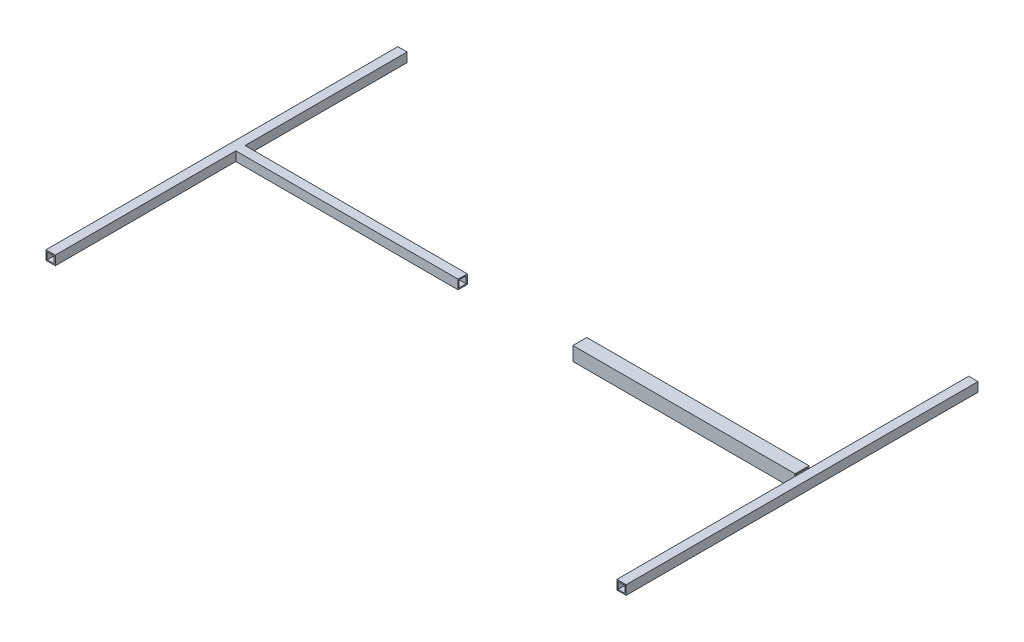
SolidWorks part; units mm, degrees
ref_plane "Front Plane" through (0, 0, 0) normal (0, 0, 1) x (1, 0, 0)
ref_plane "Top Plane" through (0, 0, 0) normal (0, 1, 0) x (1, 0, 0)
ref_plane "Right Plane" through (0, 0, 0) normal (1, 0, 0) x (0, 0, -1)
sketch "Sketch1" plane through (0, 0, 0) normal (0, 1, 0) x (1, 0, 0)
  line L0 (0, 0) -> (0, 482.6)
  line L1 (0, -385.7741) -> (0, 385.7741) construction
  line L2 (0, 254) -> (-304.8, 254)
  line L3 (-391.5217, 0) -> (-391.5217, 701.4075) construction
  line L4 (-783.0434, 254) -> (-478.2434, 254)
  line L5 (-783.0434, 0) -> (-783.0434, 482.6)
  point P13 (-783.0434, 482.6)
  dimension "D1" = 482.6
  dimension "D2" = 304.8
  dimension "D3" = 254
sketch "Sketch2" plane through (0, 0, 0) normal (0, 0, 1) x (1, 0, 0)
  line L0 (-783.0434, 0) -> (-478.2434, 0) construction
  line L1 (-789.3934, -6.35) -> (-776.6934, -6.35)
  line L2 (-789.3934, -6.35) -> (-789.3934, 6.35)
  line L3 (-789.3934, 6.35) -> (-776.6934, 6.35)
  line L4 (-776.6934, -6.35) -> (-776.6934, 6.35)
  line L5 (-789.3934, -6.35) -> (-776.6934, 6.35) construction
  line L6 (-789.3934, 6.35) -> (-776.6934, -6.35) construction
  line L8 (-6.35, -6.35) -> (6.35, -6.35)
  line L9 (-6.35, -6.35) -> (-6.35, 6.35)
  line L10 (-6.35, 6.35) -> (6.35, 6.35)
  line L11 (6.35, -6.35) -> (6.35, 6.35)
  line L12 (-6.35, -6.35) -> (6.35, 6.35) construction
  line L13 (-6.35, 6.35) -> (6.35, -6.35) construction
  line L14 (-787.8059, -4.7625) -> (-778.2809, -4.7625)
  line L15 (-787.8059, -4.7625) -> (-787.8059, 4.7625)
  line L16 (-787.8059, 4.7625) -> (-778.2809, 4.7625)
  line L17 (-778.2809, -4.7625) -> (-778.2809, 4.7625)
  line L18 (-787.8059, -4.7625) -> (-778.2809, 4.7625) construction
  line L19 (-787.8059, 4.7625) -> (-778.2809, -4.7625) construction
  line L20 (-4.7625, -4.7625) -> (4.7625, -4.7625)
  line L21 (-4.7625, -4.7625) -> (-4.7625, 4.7625)
  line L22 (-4.7625, 4.7625) -> (4.7625, 4.7625)
  line L23 (4.7625, -4.7625) -> (4.7625, 4.7625)
  line L24 (-4.7625, -4.7625) -> (4.7625, 4.7625) construction
  line L25 (-4.7625, 4.7625) -> (4.7625, -4.7625) construction
  point P0 (-783.0434, 0)
  point P7 (0, 0)
  point P13 (-783.0434, 0)
  point P18 (0, 0)
  dimension "D1" = 12.7
  dimension "D2" = 1.5875
extrude "Boss-Extrude1" add sketch "Sketch2" against normal blind 482.6
ref_plane "Plane1" through (-471.8934, 0, 0) normal (1, 0, 0) x (0, 0, -1)
sketch "Sketch5" plane through (-471.8934, 0, 0) normal (1, 0, 0) x (0, 0, -1)
  line L1 (247.65, -6.35) -> (260.35, -6.35)
  line L2 (247.65, -6.35) -> (247.65, 6.35)
  line L3 (247.65, 6.35) -> (260.35, 6.35)
  line L4 (260.35, -6.35) -> (260.35, 6.35)
  line L5 (247.65, -6.35) -> (260.35, 6.35) construction
  line L6 (247.65, 6.35) -> (260.35, -6.35) construction
  line L7 (249.2375, -4.7625) -> (258.7625, -4.7625)
  line L8 (249.2375, -4.7625) -> (249.2375, 4.7625)
  line L9 (249.2375, 4.7625) -> (258.7625, 4.7625)
  line L10 (258.7625, -4.7625) -> (258.7625, 4.7625)
  line L11 (249.2375, -4.7625) -> (258.7625, 4.7625) construction
  line L12 (249.2375, 4.7625) -> (258.7625, -4.7625) construction
  point P0 (254, 0)
  point P5 (254, 0)
  point P10 (0, 0)
  dimension "D1" = 12.7
  dimension "D2" = 1.5875
extrude "Boss-Extrude2" add sketch "Sketch5" against normal blind 304.8
ref_plane "Plane2" through (-311.15, 0, 0) normal (-1, 0, 0) x (0, 0, 1)
sketch "Sketch6" plane through (-311.15, 0, 0) normal (-1, 0, 0) x (0, 0, 1)
  line L0 (0, 0) -> (-482.6, 0) construction
  line L1 (-263.525, -9.525) -> (-244.475, -9.525)
  line L2 (-263.525, -9.525) -> (-263.525, 9.525)
  line L3 (-263.525, 9.525) -> (-244.475, 9.525)
  line L4 (-244.475, -9.525) -> (-244.475, 9.525)
  line L5 (-263.525, -9.525) -> (-244.475, 9.525) construction
  line L6 (-263.525, 9.525) -> (-244.475, -9.525) construction
  line L8 (-261.9375, -7.9375) -> (-246.0625, -7.9375)
  line L9 (-261.9375, -7.9375) -> (-261.9375, 7.9375)
  line L10 (-261.9375, 7.9375) -> (-246.0625, 7.9375)
  line L11 (-246.0625, -7.9375) -> (-246.0625, 7.9375)
  line L12 (-261.9375, -7.9375) -> (-246.0625, 7.9375) construction
  line L13 (-261.9375, 7.9375) -> (-246.0625, -7.9375) construction
  point P0 (-254, 0)
  point P7 (-254, 0)
  point P12 (0, 0)
  dimension "D1" = 19.05
  dimension "D2" = 1.5875
extrude "Boss-Extrude3" add sketch "Sketch6" against normal blind 304.8 contours L8 L11 L10 L9 | L2 L1 L4 L3
